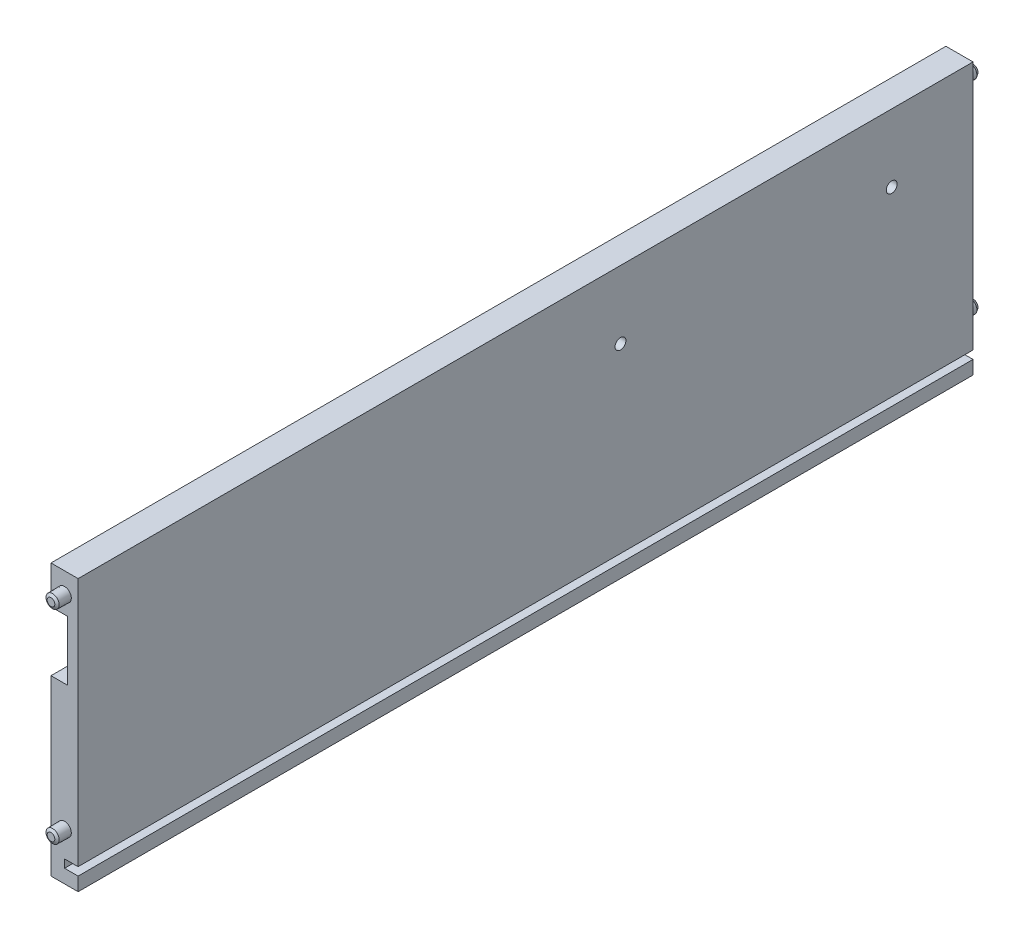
SolidWorks part; units mm, degrees
ref_plane "Front Plane" through (0, 0, 0) normal (0, 0, 1) x (1, 0, 0)
ref_plane "Top Plane" through (0, 0, 0) normal (0, 1, 0) x (1, 0, 0)
ref_plane "Right Plane" through (0, 0, 0) normal (1, 0, 0) x (0, 0, -1)
sketch "Sketch1" plane through (0, 0, 0) normal (1, 0, 0) x (0, 0, -1)
  line L1 (-165, -50) -> (165, -50)
  line L2 (-165, -50) -> (-165, 50)
  line L3 (-165, 50) -> (165, 50)
  line L4 (165, -50) -> (165, 50)
  line L5 (-165, -50) -> (165, 50) construction
  line L6 (-165, 50) -> (165, -50) construction
  point P0 (0, 0)
  dimension "D1" = 100
  dimension "D2" = 330
extrude "Boss-Extrude1" add sketch "Sketch1" along normal blind 10
sketch "Sketch2" plane through (0, 0, 0) normal (-1, 0, 0) x (0, 0, 1)
  line L0 (165, 50) -> (165, -50) construction
  line L1 (-165, 36) -> (165, 36)
  line L2 (-165, 36) -> (-165, 14)
  line L3 (-165, 14) -> (165, 14)
  line L4 (165, 36) -> (165, 14)
  line L5 (-165, 36) -> (165, 14) construction
  line L6 (-165, 14) -> (165, 36) construction
  line L7 (0, 0) -> (0, 25) construction
  point P0 (0, 25)
  dimension "D1" = 22
  dimension "D2" = 25
extrude "Cut-Extrude1" cut sketch "Sketch2" against normal blind 6
sketch "Sketch3" plane through (6, 0, 0) normal (-1, 0, 0) x (0, 0, 1)
  line L0 (-165, 25) -> (75.9783, 25) construction
  line L1 (-165, 36) -> (-165, 14) construction
  line L2 (165, 50) -> (165, -50) construction
  line L3 (-85, 25) -> (-85, 20.6277) construction
  circle A0 centre (-135, 25) radius 2
  circle A1 centre (-35, 25) radius 2
  dimension "D2" = 4
  dimension "D1" = 100
  dimension "D3" = 200
extrude "Cut-Extrude2" cut sketch "Sketch3" against normal blind 10
sketch "Sketch4" plane through (0, 0, -165) normal (0, 0, -1) x (-1, 0, 0)
  line L0 (-5, 50) -> (-5, 42.5) construction
  line L1 (-10, 50) -> (0, 50) construction
  line L2 (-5, 42.5) -> (-5, 5) construction
  line L3 (-5, 5) -> (0, 5) construction
  line L4 (-10, -50) -> (0, -50) construction
  circle A0 centre (-5, 42.5) radius 2.5
  circle A1 centre (-5, -32.5) radius 2.5
  point P10 (-5, -50)
  dimension "D1" = 5
  dimension "D2" = 75
  dimension "D3" = 17.5
extrude "Boss-Extrude2" add sketch "Sketch4" along normal blind 5 draft 1
mirror "Mirror1" about plane through (0, 0, 0) normal (0, 0, 1) of "Boss-Extrude2"
chamfer "Chamfer1" distance 1 angle 30 4 edges at (2.5873, 42.5, -170) (7.4127, -32.5, -170) (7.4127, 42.5, 170) (2.5873, -32.5, 170)
sketch "Sketch5" plane through (10, 0, 0) normal (1, 0, 0) x (0, 0, -1)
  line L0 (-165, 50) -> (-165, -50) construction
  line L1 (-165, -42) -> (165, -42)
  line L2 (-165, -42) -> (-165, -45)
  line L3 (-165, -45) -> (165, -45)
  line L4 (165, -42) -> (165, -45)
  line L5 (165, -50) -> (165, 50) construction
  line L6 (-165, -50) -> (165, -50) construction
  dimension "D1" = 3
  dimension "D2" = 5
extrude "Cut-Extrude3" cut sketch "Sketch5" against normal blind 5
